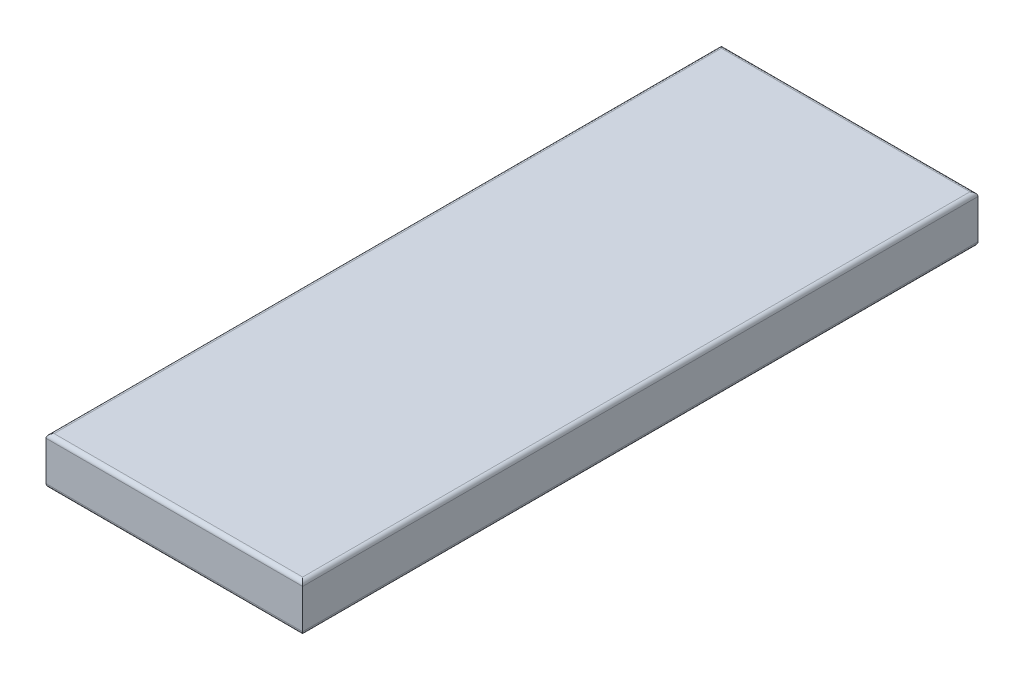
SolidWorks part; units mm, degrees
ref_plane "Спереди" through (0, 0, 0) normal (0, 0, 1) x (1, 0, 0)
ref_plane "Сверху" through (0, 0, 0) normal (0, 1, 0) x (1, 0, 0)
ref_plane "Справа" through (0, 0, 0) normal (1, 0, 0) x (0, 0, -1)
sketch "Эскиз1" plane through (0, 0, 0) normal (0, 0, 1) x (1, 0, 0)
  line L1 (-9.5, 1.75) -> (9.5, 1.75)
  line L2 (-9.5, 1.75) -> (-9.5, -1.75)
  line L3 (-9.5, -1.75) -> (9.5, -1.75)
  line L4 (9.5, 1.75) -> (9.5, -1.75)
  line L5 (0, -1.75) -> (0, 1.75) construction
  line L6 (-9.5, 0) -> (9.5, 0) construction
  point P0 (0, 0)
  dimension "D1" = 3.5
  dimension "D2" = 19
extrude "Бобышка-Вытянуть1" add sketch "Эскиз1" along normal blind 50
fillet "Скругление1" radius 0.3 8 edges at (-9.5, -1.75, 25) (0, -1.75, 50) (9.5, -1.75, 25) (0, -1.75, 0) (9.5, 1.75, 25) (0, 1.75, 50) (-9.5, 1.75, 25) (0, 1.75, 0)
